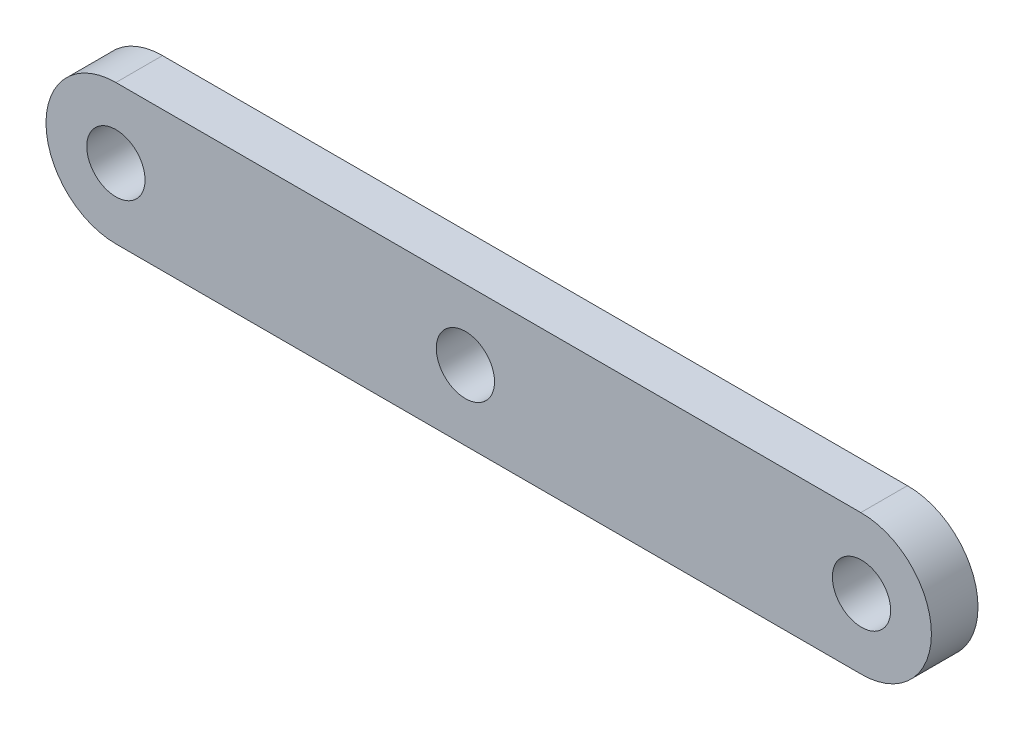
SolidWorks part; units mm, degrees
ref_plane "前视基准面" through (0, 0, 0) normal (0, 0, 1) x (1, 0, 0)
ref_plane "上视基准面" through (0, 0, 0) normal (0, 1, 0) x (1, 0, 0)
ref_plane "右视基准面" through (0, 0, 0) normal (1, 0, 0) x (0, 0, -1)
sketch "草图1" plane through (0, 0, 0) normal (0, 0, 1) x (1, 0, 0)
  line L0 (-15, 0) -> (15, 0) construction
  line L1 (-15, 6) -> (48.94, 5.9997)
  line L2 (-14.9991, -6) -> (48.9383, -5.9997)
  arc A0 (-15, 6) -> (-14.9991, -6) centre (-15, 0) ccw
  circle A1 centre (49, 0) radius 2.5
  circle A2 centre (15, 0) radius 2.5
  circle A3 centre (-15, 0) radius 2.5
  arc A5 (48.9383, -5.9997) -> (48.94, 5.9997) centre (49, 0) ccw
  point P2 (0, 0)
extrude "凸台-拉伸1" add sketch "草图1" along normal blind 4
